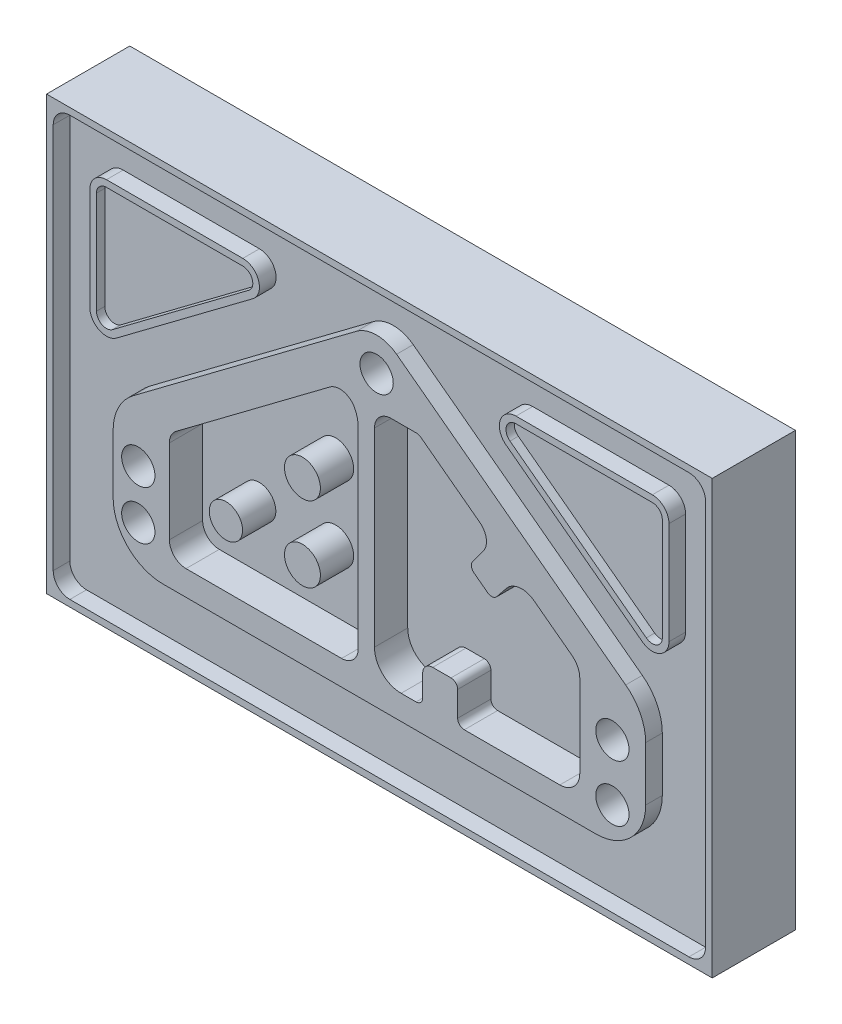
SolidWorks part; units mm, degrees
ref_plane "Plane1" through (0, 0, 0) normal (0, 0, 1) x (1, 0, 0)
ref_plane "Plane2" through (0, 0, 0) normal (0, 1, 0) x (-1, 0, 0)
ref_plane "Plane3" through (0, 0, 0) normal (1, 0, 0) x (0, 0, -1)
sketch "Sketch1" plane through (0, 0, 0) normal (0, 0, 1) x (1, 0, 0)
  line L4 (-13.6667, 109.75) -> (-148, 9)
  line L5 (10.3333, 109.75) -> (148, 6.5)
  line L6 (-160, -15) -> (-160, -50)
  line L7 (160, -17.5) -> (160, -50)
  line L8 (130, -80) -> (-130, -80)
  arc A0 (10.3333, 109.75) -> (-13.6667, 109.75) centre (-1.6667, 93.75) ccw
  arc A1 (-160, -15) -> (-148, 9) centre (-130, -15) cw
  arc A2 (-130, -80) -> (-160, -50) centre (-130, -50) cw
  arc A3 (130, -80) -> (160, -50) centre (130, -50) ccw
  arc A4 (160, -17.5) -> (148, 6.5) centre (130, -17.5) ccw
  dimension "D1" = 20
  dimension "D2" = 30
  dimension "D3" = 30
  dimension "D4" = 30
  dimension "D5" = 30
extrude "Base - Triangle" add sketch "Sketch1" along normal blind 50
sketch "Sketch5" plane through (0, 0, 0) normal (0, 0, 1) x (1, 0, 0)
  line L0 (-200, -120) -> (200, -120)
  line L1 (-200, -120) -> (-200, 140)
  line L2 (200, 140) -> (-200, 140)
  line L3 (200, 140) -> (200, -120)
extrude "Base - Rectangle" add sketch "Sketch5" along normal blind 40
sketch "Sketch2" plane through (0, 0, 50) normal (0, 0, 1) x (1, 0, 0)
  line L1 (-126.2039, -4.6529) -> (-126.2039, -55.0614)
  line L2 (-116.2039, -65.0614) -> (-22.7292, -65.0614)
  line L3 (-12.7292, -55.0614) -> (-12.7292, 60.2006)
  line L4 (-2.9691, 64.7239) -> (-2.9691, -49.3197)
  line L5 (7.0309, 74.7239) -> (22.3681, 74.7239)
  line L6 (24.7681, 73.9239) -> (60.344, 47.242)
  line L7 (62.344, 33.242) -> (56.03, 24.8234)
  line L8 (56.83, 19.2234) -> (65.0483, 13.0597)
  line L9 (70.5716, 13.7606) -> (76.2126, 20.8105)
  line L10 (13.0309, -65.3197) -> (22.0119, -65.3197)
  line L11 (120.4179, -3.8135) -> (120.4179, -53.3197)
  line L12 (26.0119, -61.3197) -> (26.0119, -48.3197)
  line L13 (32.0119, -42.3197) -> (43.0119, -42.3197)
  line L14 (47.0119, -46.3197) -> (47.0119, -61.3197)
  line L15 (92.7823, 22.9133) -> (115.6179, 5.7865)
  line L16 (51.0119, -65.3197) -> (108.4179, -65.3197)
  line L17 (-29.7808, 72.6644) -> (-122.2039, 3.3471)
  line L18 (10.3333, 109.75) -> (148, 6.5) construction
  line L19 (-13.6667, 109.75) -> (-148, 9) construction
  arc A0 (-12.7292, 60.2006) -> (-14.8324, 69.1283) centre (-32.7292, 60.2006) ccw
  arc A1 (-126.2039, -4.6529) -> (-122.2039, 3.3471) centre (-116.2039, -4.6529) cw
  arc A2 (-116.2039, -65.0614) -> (-126.2039, -55.0614) centre (-116.2039, -55.0614) cw
  arc A3 (-22.7292, -65.0614) -> (-12.7292, -55.0614) centre (-22.7292, -55.0614) ccw
  arc A4 (-2.9691, 64.7239) -> (7.0309, 74.7239) centre (7.0309, 64.7239) cw
  arc A5 (62.344, 33.242) -> (60.344, 47.242) centre (54.344, 39.242) ccw
  arc A6 (56.83, 19.2234) -> (56.03, 24.8234) centre (59.23, 22.4234) cw
  arc A7 (70.5716, 13.7606) -> (65.0483, 13.0597) centre (67.4483, 16.2597) cw
  arc A8 (92.7823, 22.9133) -> (76.2126, 20.8105) centre (85.5823, 13.3133) ccw
  arc A9 (120.4179, -3.8135) -> (115.6179, 5.7865) centre (108.4179, -3.8135) ccw
  arc A10 (108.4179, -65.3197) -> (120.4179, -53.3197) centre (108.4179, -53.3197) ccw
  arc A11 (51.0119, -65.3197) -> (47.0119, -61.3197) centre (51.0119, -61.3197) cw
  arc A12 (43.0119, -42.3197) -> (47.0119, -46.3197) centre (43.0119, -46.3197) cw
  arc A13 (26.0119, -48.3197) -> (32.0119, -42.3197) centre (32.0119, -48.3197) cw
  arc A14 (-2.9691, -49.3197) -> (13.0309, -65.3197) centre (13.0309, -49.3197) ccw
  arc A15 (26.0119, -61.3197) -> (22.0119, -65.3197) centre (22.0119, -61.3197) cw
  arc A16 (22.3681, 74.7239) -> (24.7681, 73.9239) centre (22.3681, 70.7239) cw
  arc A17 (-29.7808, 72.6644) -> (-14.8324, 69.1283) centre (-23.7808, 64.6644) cw
  dimension "D1" = 20
  dimension "D2" = 10
  dimension "D3" = 10
  dimension "D4" = 10
  dimension "D5" = 10
  dimension "D6" = 10
  dimension "D7" = 4
  dimension "D8" = 4
  dimension "D9" = 12
  dimension "D10" = 12
  dimension "D11" = 12
  dimension "D12" = 4
  dimension "D13" = 4
  dimension "D14" = 6
  dimension "D15" = 16
  dimension "D16" = 4
  dimension "D17" = 4
  dimension "D18" = 10
  dimension "D19" = 20
  dimension "D20" = 20
extrude "Pockets" cut sketch "Sketch2" against normal blind 20
sketch "Sketch3" plane through (0, 0, 50) normal (0, 0, 1) x (1, 0, 0)
  circle A0 centre (-144.8804, -26.0834) radius 10
  circle A1 centre (-144.8804, -55.4543) radius 10
  circle A2 centre (140, -26.0834) radius 10
  circle A3 centre (140, -60) radius 10
  circle A4 centre (-1.6667, 93.75) radius 10
extrude "Cut - Holes" cut sketch "Sketch3" against normal blind 40
sketch "Sketch4" plane through (0, 0, 30) normal (0, 0, 1) x (1, 0, 0)
  circle A0 centre (-46.2462, 17.1616) radius 10.7866
  circle A1 centre (-46.2462, -28.1718) radius 10.7866
  circle A2 centre (-92.2225, -28.1718) radius 10
extrude "Pocket Boss'" add sketch "Sketch4" along normal blind 20
sketch "Sketch6" plane through (0, 0, 40) normal (0, 0, 1) x (1, 0, 0)
  line L4 (-196, 136) -> (-196, -116)
  line L5 (-196, -116) -> (196, -116)
  line L6 (196, -116) -> (196, 136)
  line L7 (196, 136) -> (-196, 136)
  line L8 (-196, 126) -> (-196, -106)
  line L9 (-186, -116) -> (186, -116)
  line L10 (196, -106) -> (196, 126)
  line L11 (186, 136) -> (-186, 136)
  line L12 (-200, 140) -> (-200, -120)
  line L13 (-200, -120) -> (200, -120)
  line L14 (200, -120) -> (200, 140)
  line L15 (200, 140) -> (-200, 140)
  line L16 (-200, 140) -> (-200, -120)
  line L17 (-200, -120) -> (200, -120)
  line L18 (200, -120) -> (200, 140)
  line L19 (200, 140) -> (-200, 140)
  arc A0 (-196, 126) -> (-186, 136) centre (-186, 126) cw
  arc A1 (-186, -116) -> (-196, -106) centre (-186, -106) cw
  arc A2 (196, -106) -> (186, -116) centre (186, -106) cw
  arc A3 (186, 136) -> (196, 126) centre (186, 126) cw
  dimension "D3" = 10
  dimension "D4" = 10
  dimension "D5" = 10
  dimension "D6" = 10
  dimension "D1" = 4
  dimension "D2" = 0
extrude "Rim" add sketch "Sketch6" along normal blind 10
sketch "Sketch7" plane through (0, 0, 40) normal (0, 0, 1) x (1, 0, 0)
  line L0 (-164, 113.4481) -> (-82.0692, 113.4481)
  line L1 (-174, 103.4481) -> (-174, 42)
  line L2 (-158, 34) -> (-76.0692, 95.4481)
  line L3 (0, 140) -> (0, -120) construction
  line L4 (158, 34) -> (76.0692, 95.4481)
  line L5 (174, 103.4481) -> (174, 42)
  line L6 (164, 113.4481) -> (82.0692, 113.4481)
  arc A0 (-82.0692, 113.4481) -> (-76.0692, 95.4481) centre (-82.0692, 103.4481) cw
  arc A1 (-174, 103.4481) -> (-164, 113.4481) centre (-164, 103.4481) cw
  arc A2 (-158, 34) -> (-174, 42) centre (-164, 42) cw
  arc A3 (158, 34) -> (174, 42) centre (164, 42) ccw
  arc A4 (174, 103.4481) -> (164, 113.4481) centre (164, 103.4481) ccw
  arc A5 (82.0692, 113.4481) -> (76.0692, 95.4481) centre (82.0692, 103.4481) ccw
  dimension "D1" = 10
  dimension "D2" = 10
  dimension "D3" = 10
extrude "Tri - Boss'" add sketch "Sketch7" along normal blind 10
sketch "Sketch8" plane through (0, 0, 50) normal (0, 0, 1) x (1, 0, 0)
  line L3 (-82.0692, 109.4481) -> (-164, 109.4481)
  line L4 (-170, 103.4481) -> (-170, 42)
  line L5 (-160.4, 37.2) -> (-78.4692, 98.6481)
  line L6 (-82.0692, 109.4481) -> (-164, 109.4481)
  line L7 (-170, 103.4481) -> (-170, 42)
  line L8 (-160.4, 37.2) -> (-78.4692, 98.6481)
  line L9 (170, 42) -> (170, 103.4481)
  line L10 (164, 109.4481) -> (82.0692, 109.4481)
  line L11 (78.4692, 98.6481) -> (160.4, 37.2)
  line L12 (170, 42) -> (170, 103.4481)
  line L13 (164, 109.4481) -> (82.0692, 109.4481)
  line L14 (78.4692, 98.6481) -> (160.4, 37.2)
  arc A3 (-78.4692, 98.6481) -> (-82.0692, 109.4481) centre (-82.0692, 103.4481) ccw
  arc A4 (-164, 109.4481) -> (-170, 103.4481) centre (-164, 103.4481) ccw
  arc A5 (-170, 42) -> (-160.4, 37.2) centre (-164, 42) ccw
  arc A6 (-78.4692, 98.6481) -> (-82.0692, 109.4481) centre (-82.0692, 103.4481) ccw
  arc A7 (-164, 109.4481) -> (-170, 103.4481) centre (-164, 103.4481) ccw
  arc A8 (-170, 42) -> (-160.4, 37.2) centre (-164, 42) ccw
  arc A9 (160.4, 37.2) -> (170, 42) centre (164, 42) ccw
  arc A10 (170, 103.4481) -> (164, 109.4481) centre (164, 103.4481) ccw
  arc A11 (82.0692, 109.4481) -> (78.4692, 98.6481) centre (82.0692, 103.4481) ccw
  arc A12 (160.4, 37.2) -> (170, 42) centre (164, 42) ccw
  arc A13 (170, 103.4481) -> (164, 109.4481) centre (164, 103.4481) ccw
  arc A14 (82.0692, 109.4481) -> (78.4692, 98.6481) centre (82.0692, 103.4481) ccw
  dimension "D1" = 4
  dimension "D2" = 4
extrude "Tri - Pock's" cut sketch "Sketch8" against normal blind 5
